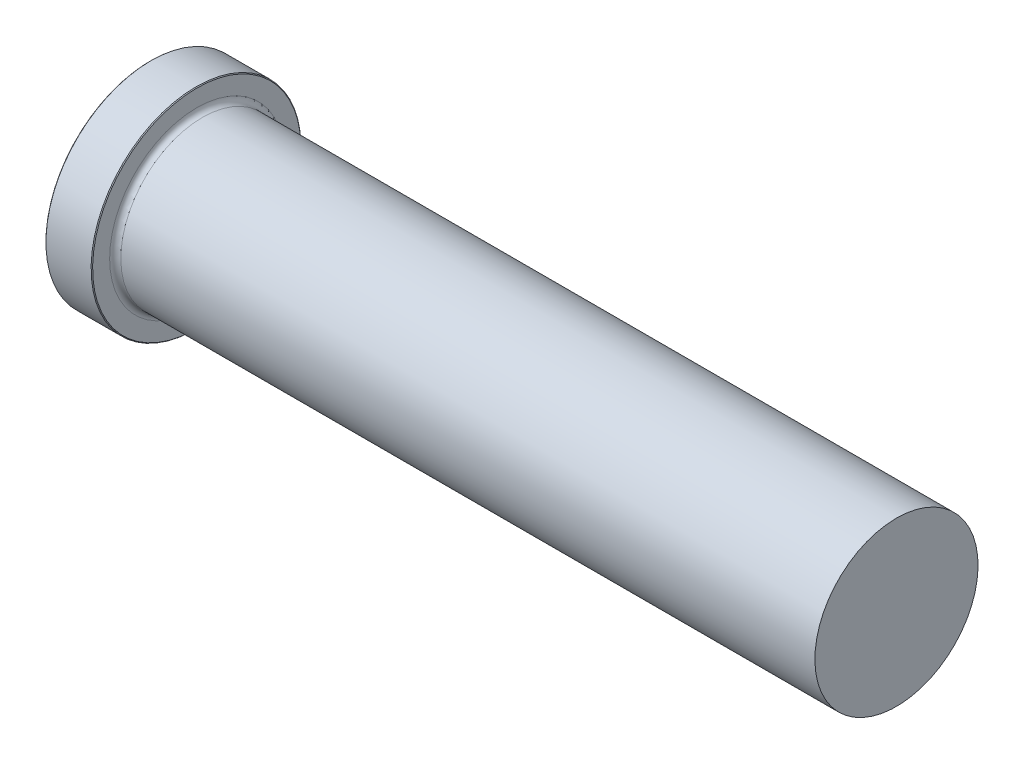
SolidWorks part; units mm, degrees
ref_plane "Front Plane" through (0, 0, 0) normal (0, 0, 1) x (1, 0, 0)
ref_plane "Top Plane" through (0, 0, 0) normal (0, 1, 0) x (1, 0, 0)
ref_plane "Right Plane" through (0, 0, 0) normal (1, 0, 0) x (0, 0, -1)
sketch "Sketch1" plane through (0, 0, 0) normal (0, 0, 1) x (1, 0, 0)
  line L0 (0, 0) -> (0, 14.2875)
  line L1 (0, 14.2875) -> (6.35, 14.2875)
  line L2 (6.35, 14.2875) -> (6.35, 11.8681)
  line L3 (7.112, 11.1061) -> (101.6, 11.1061)
  line L4 (101.6, 11.1061) -> (101.6, 0)
  line L5 (101.6, 0) -> (0, 0)
  line L6 (101.6, 0) -> (101.6, -11.1061) construction
  line L7 (101.6, -11.1061) -> (6.35, -11.1062) construction
  line L8 (0, 0) -> (0, -14.2875) construction
  line L9 (0, -14.2875) -> (6.35, -14.2875) construction
  line L10 (6.35, -14.2875) -> (6.35, -11.1062) construction
  arc A0 (6.35, 11.8681) -> (7.112, 11.1061) centre (7.112, 11.8681) ccw
  dimension "D4" = 0.762
  dimension "L" = 101.6
  dimension "D" = 22.2123
  dimension "H" = 28.575
  dimension "T" = 6.35
revolve "Revolve1" add sketch "Sketch1" angle 360 about L5
chamfer "Chamfer1" distance 0.1016 angle 45 2 edges at (0, 14.2875, 0) (6.35, 14.2875, 0)
